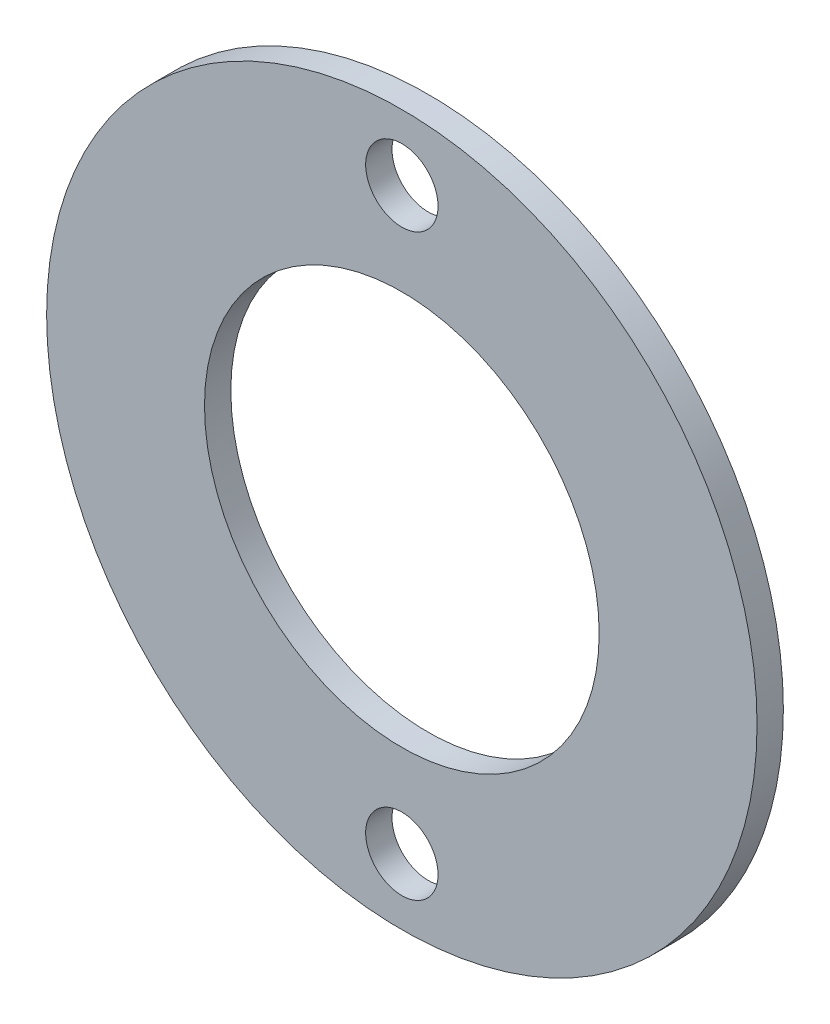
SolidWorks part; units mm, degrees
ref_plane "Face" through (0, 0, 0) normal (0, 0, 1) x (1, 0, 0)
ref_plane "Dessus" through (0, 0, 0) normal (0, 1, 0) x (1, 0, 0)
ref_plane "Droite" through (0, 0, 0) normal (1, 0, 0) x (0, 0, -1)
sketch "Esquisse1" plane through (0, 0, 0) normal (0, 0, 1) x (1, 0, 0)
  line L1 (5.7735, 10) -> (-5.7735, 10) construction
  line L2 (-5.7735, 10) -> (-11.547, 0) construction
  line L3 (-11.547, 0) -> (-5.7735, -10) construction
  line L4 (-5.7735, -10) -> (5.7735, -10) construction
  line L5 (5.7735, -10) -> (11.547, 0) construction
  line L6 (11.547, 0) -> (5.7735, 10) construction
  circle A0 centre (0, 0) radius 27
  circle A1 centre (0, 22) radius 2.75
  circle A2 centre (0, -22) radius 2.75
  circle A3 centre (0, 0) radius 10 construction
  circle A4 centre (0, 0) radius 15
  dimension "D1" = 54
  dimension "D4" = 5.5
  dimension "D6" = 30
  dimension "D2" = 22
  dimension "D3" = 22
  dimension "D5" = 20
extrude "Extrusion1" add sketch "Esquisse1" along normal blind 2
